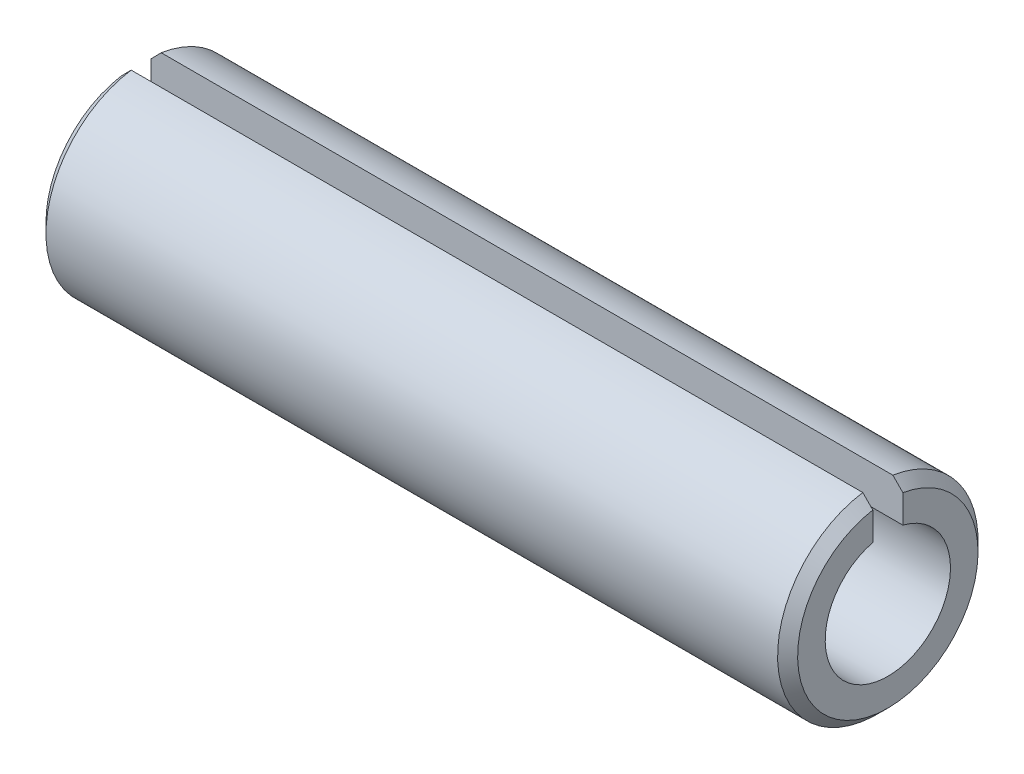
SolidWorks part; units mm, degrees
ref_plane "Plan1" through (0, 0, 0) normal (0, 0, 1) x (1, 0, 0)
ref_plane "Plan2" through (0, 0, 0) normal (0, 1, 0) x (1, 0, 0)
ref_plane "Plan3" through (0, 0, 0) normal (1, 0, 0) x (0, 0, -1)
sketch "Esquisse1" plane through (0, 0, 0) normal (0, 0, 1) x (1, 0, 0)
  line L0 (0, 2.5) -> (0, 3.6)
  line L1 (0, 2.5) -> (30, 2.5)
  line L2 (30, 2.5) -> (30, 3.6)
  line L3 (30, 3.6) -> (29.6, 4)
  line L4 (29.6, 4) -> (0.4, 4)
  line L5 (0.4, 4) -> (0, 3.6)
  line L6 (0, 0) -> (30, 0) construction
  dimension "D1" = 30
  dimension "D2" = 4
  dimension "D3" = 1.5
  dimension "D4" = 45
  dimension "D5" = 45
  dimension "D6" = 0.4
revolve "Base-Révolution" add sketch "Esquisse1" angle 360 about L6
sketch "Esquisse2" plane through (0, 0, 0) normal (1, 0, 0) x (0, 0, -1)
  line L0 (0, 0) -> (0, 4) construction
  line L1 (0.6, 3.9547) -> (0.6, 2.4269)
  line L2 (-0.6, 3.9547) -> (-0.6, 2.4269)
  circle A0 centre (0, 0) radius 4 construction
  circle A1 centre (0, 0) radius 2.5 construction
  arc A2 (0.6, 2.4269) -> (-0.6, 2.4269) centre (0, 0) ccw
  arc A3 (0.6, 3.9547) -> (-0.6, 3.9547) centre (0, 0) ccw
  dimension "D1" = 0.6
extrude "Enlèv. mat.-Extru.2" cut sketch "Esquisse2" along normal through all
equation "\"D6@Esquisse1\"=\"D2@Esquisse1\"/10"
equation "\"D1@Esquisse2\"=\"D3@Esquisse1\"/2.5"
